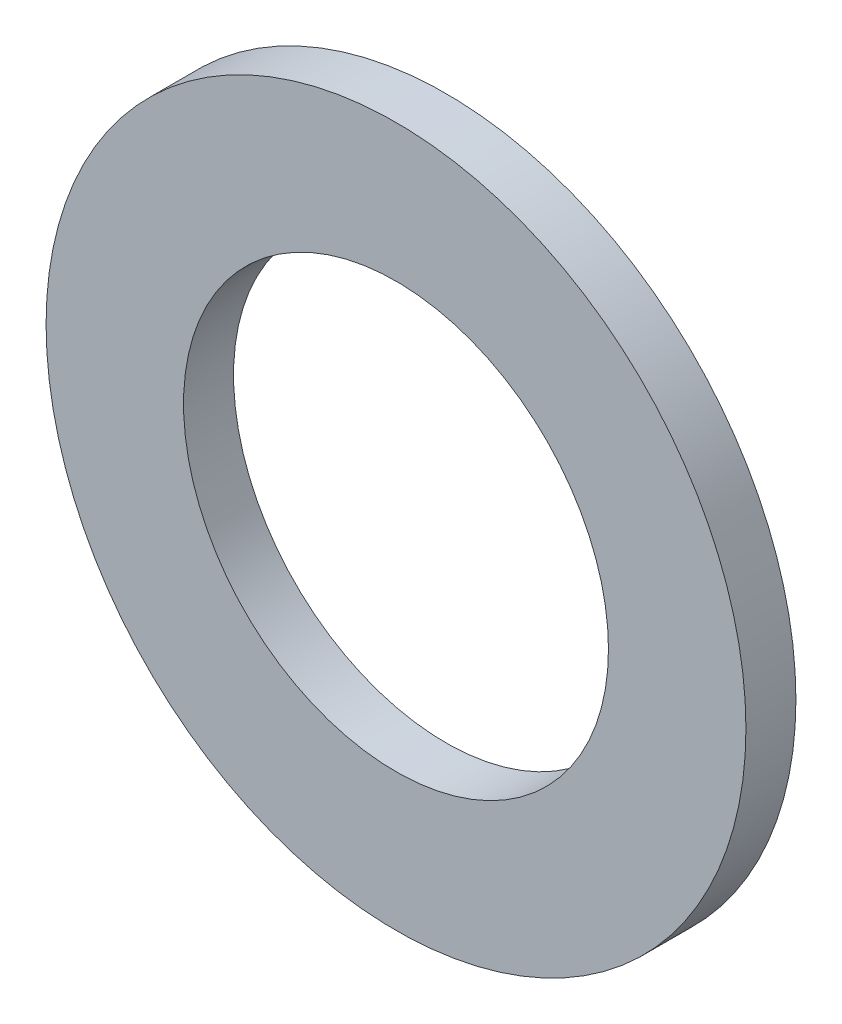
SolidWorks part; units mm, degrees
ref_plane "Plan1" through (0, 0, 0) normal (0, 0, 1) x (1, 0, 0)
ref_plane "Plan2" through (0, 0, 0) normal (0, 1, 0) x (1, 0, 0)
ref_plane "Plan3" through (0, 0, 0) normal (1, 0, 0) x (0, 0, -1)
sketch "Esquisse1" plane through (0, 0, 0) normal (0, 0, 1) x (1, 0, 0)
  circle A0 centre (0, 0) radius 7
  circle A1 centre (0, 0) radius 4.25
  dimension "D1" = 8.5
  dimension "D2" = 14
extrude "Base-Extrusion" add sketch "Esquisse1" along normal blind 1
